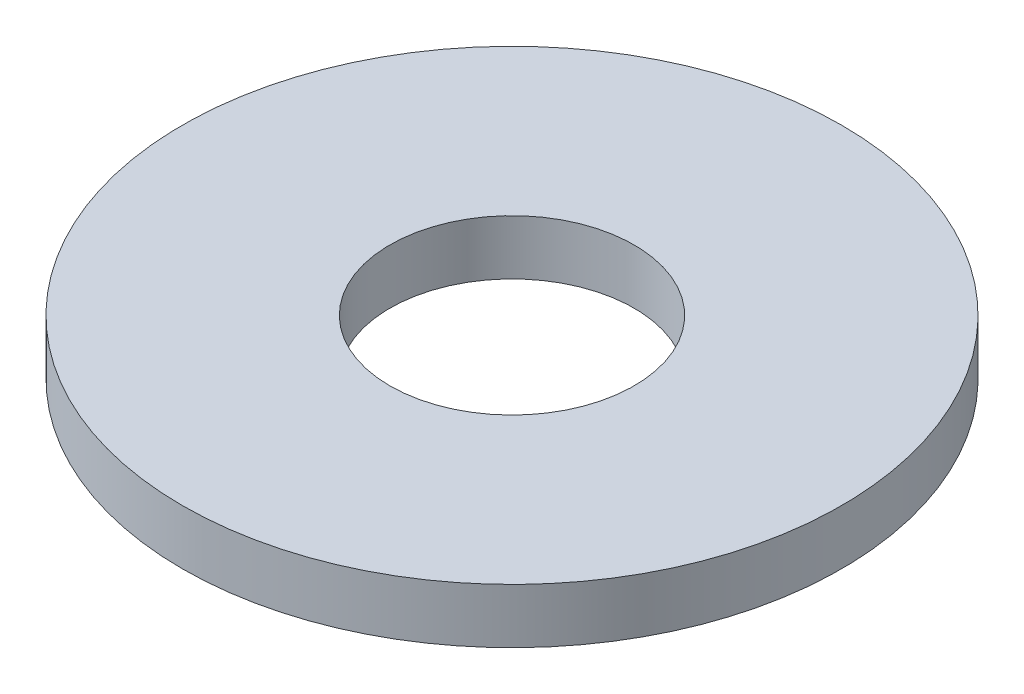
SolidWorks part; units mm, degrees
ref_plane "Front Plane" through (0, 0, 0) normal (0, 0, 1) x (1, 0, 0)
ref_plane "Top Plane" through (0, 0, 0) normal (0, 1, 0) x (1, 0, 0)
ref_plane "Right Plane" through (0, 0, 0) normal (1, 0, 0) x (0, 0, -1)
sketch "Sketch1" plane through (0, 0, 0) normal (0, 1, 0) x (1, 0, 0)
  circle A0 centre (0, 0) radius 5.3467
  circle A1 centre (0, 0) radius 1.9812
  dimension "D1" = 3.9624
  dimension "D2" = 10.6934
extrude "Boss-Extrude1" add sketch "Sketch1" along normal blind 0.889
